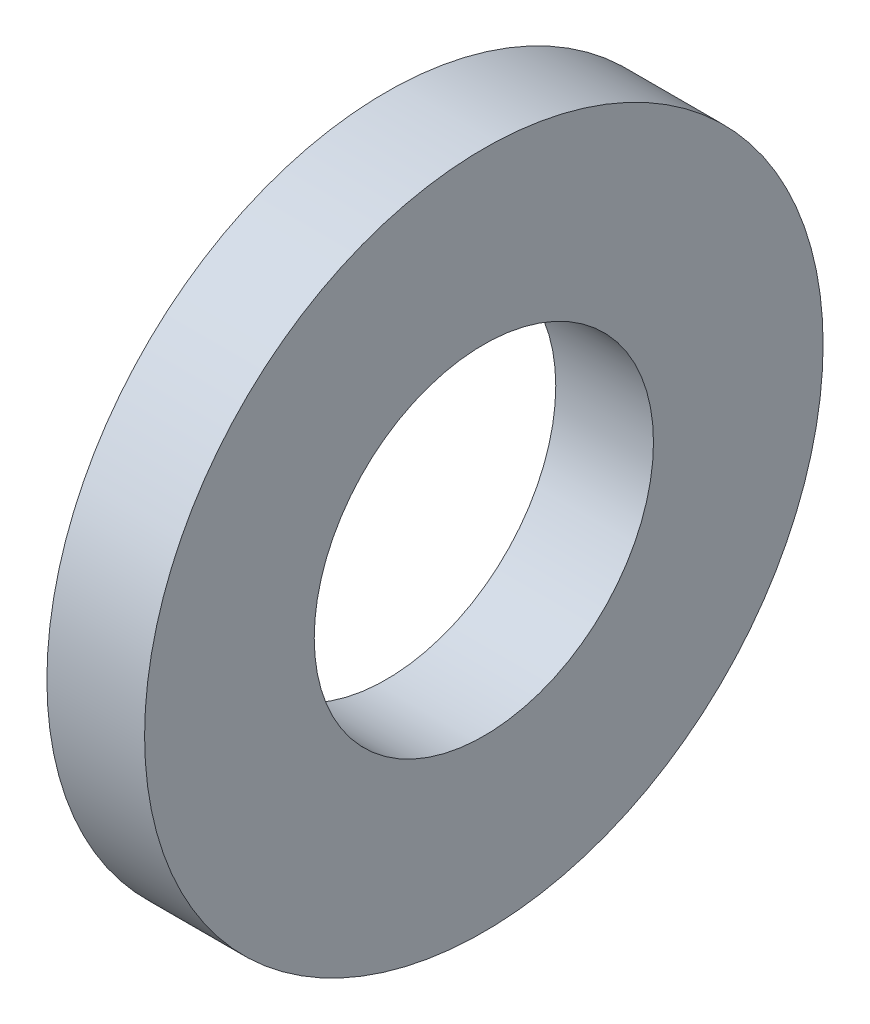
SolidWorks part; units mm, degrees
ref_plane "Front Plane" through (0, 0, 0) normal (0, 0, 1) x (1, 0, 0)
ref_plane "Top Plane" through (0, 0, 0) normal (0, 1, 0) x (1, 0, 0)
ref_plane "Right Plane" through (0, 0, 0) normal (1, 0, 0) x (0, 0, -1)
sketch "Sketch1" plane through (0, 0, 0) normal (1, 0, 0) x (0, 0, -1)
  circle A0 centre (0, 0) radius 3.175
  circle A1 centre (0, 0) radius 1.5875
  dimension "OD" = 6.35
  dimension "ID" = 3.175
extrude "Boss-Extrude1" add sketch "Sketch1" along normal blind 0.9144
